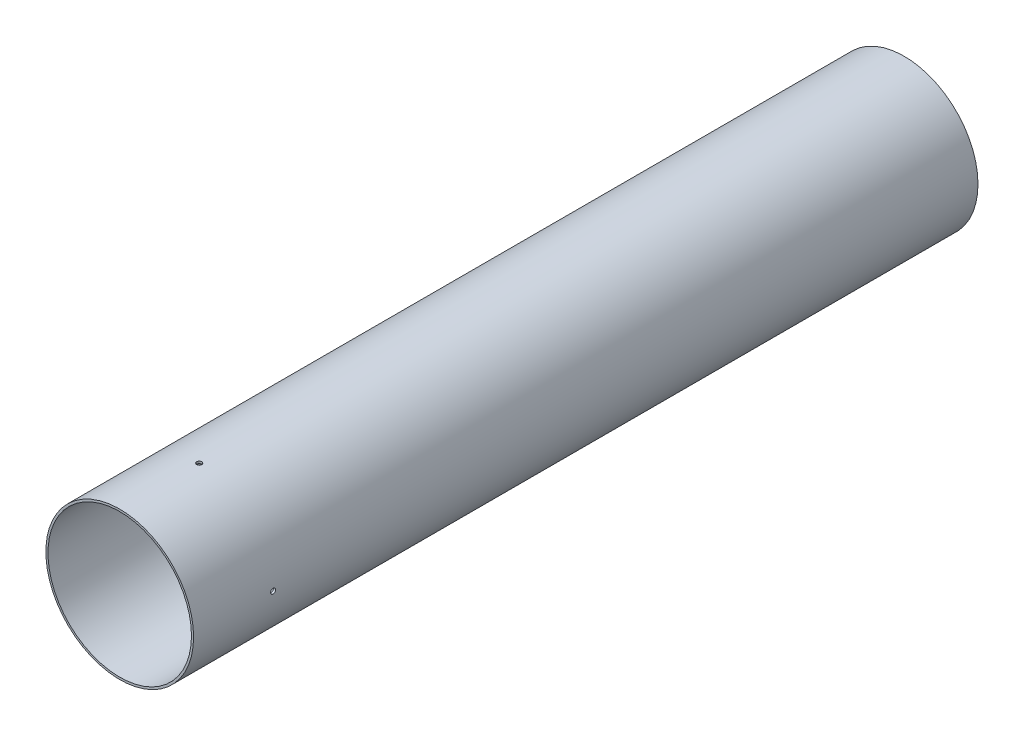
SolidWorks part; units mm, degrees
ref_plane "Front Plane" through (0, 0, 0) normal (0, 0, 1) x (1, 0, 0)
ref_plane "Top Plane" through (0, 0, 0) normal (0, 1, 0) x (1, 0, 0)
ref_plane "Right Plane" through (0, 0, 0) normal (1, 0, 0) x (0, 0, -1)
sketch "Sketch1" plane through (0, 0, 0) normal (0, 0, 1) x (1, 0, 0)
  circle A0 centre (0, 0) radius 70.0786
  circle A1 centre (0, 0) radius 68.072
  dimension "D1" = 136.144
  dimension "D2" = 140.1572
extrude "Boss-Extrude1" add sketch "Sketch1" along normal blind 744.22
sketch "Sketch2" plane through (0, 0, 0) normal (1, 0, 0) x (0, 0, -1)
  line L1 (-744.22, 70.0786) -> (-744.22, -70.0786) construction
  circle A0 centre (-668.815, 0) radius 2.4003
  dimension "D2" = 4.8006
  dimension "D1" = 75.405
extrude "Cut-Extrude1" cut sketch "Sketch2" against normal through all both and the other way through all
sketch "Sketch3" plane through (0, 0, 0) normal (0, 1, 0) x (1, 0, 0)
  line L0 (-70.0786, -744.22) -> (70.0786, -744.22) construction
  circle A0 centre (0, -668.815) radius 2.4003
  dimension "D1" = 75.405
  dimension "D2" = 4.8006
extrude "Cut-Extrude2" cut sketch "Sketch3" against normal through all both and the other way through all
